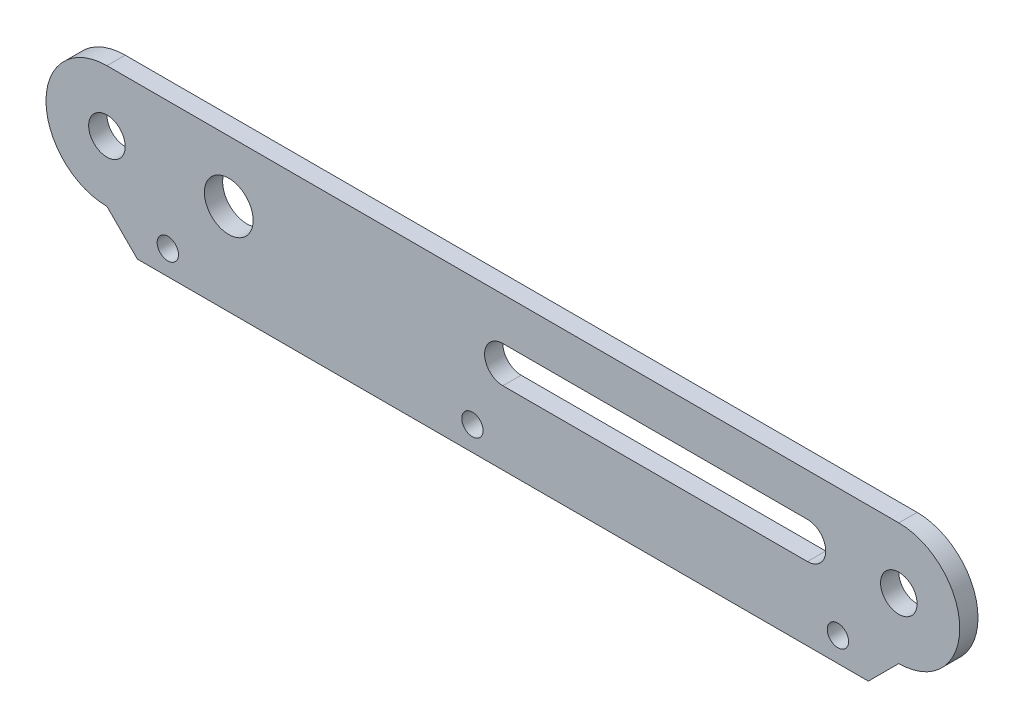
SolidWorks part; units mm, degrees
ref_plane "Front Plane" through (0, 0, 0) normal (0, 0, 1) x (1, 0, 0)
ref_plane "Top Plane" through (0, 0, 0) normal (0, 1, 0) x (1, 0, 0)
ref_plane "Right Plane" through (0, 0, 0) normal (1, 0, 0) x (0, 0, -1)
sketch "Sketch1" plane through (0, 0, 0) normal (0, 0, 1) x (1, 0, 0)
  line L0 (0, 0) -> (130, 0) construction
  line L1 (65, 0) -> (115, 0) construction
  line L2 (65, 3) -> (115, 3)
  line L3 (65, -3) -> (115, -3)
  line L4 (0, 10) -> (130, 10)
  line L5 (0, -10) -> (5, -15)
  line L6 (5, -15) -> (125, -15)
  line L7 (125, -15) -> (130, -10)
  line L8 (1, -11) -> (129, -11) construction
  circle A0 centre (0, 0) radius 3
  circle A1 centre (20, 0) radius 4
  circle A2 centre (130, 0) radius 3
  arc A3 (65, 3) -> (65, -3) centre (65, 0) ccw
  arc A4 (115, -3) -> (115, 3) centre (115, 0) ccw
  arc A5 (0, 10) -> (0, -10) centre (0, 0) ccw
  arc A6 (130, -10) -> (130, 10) centre (130, 0) ccw
  circle A7 centre (10, -11) radius 1.75
  circle A8 centre (60, -11) radius 1.75
  circle A9 centre (120, -11) radius 1.75
  point P9 (90, 0)
  dimension "D1" = 6
  dimension "D2" = 8
  dimension "D3" = 6
  dimension "D4" = 3
  dimension "D9" = 10
  dimension "D14" = 3.5
  dimension "D15" = 10
  dimension "D16" = 50
  dimension "D17" = 60
  dimension "D5" = 15
  dimension "D6" = 50
  dimension "D7" = 45
  dimension "D8" = 20
  dimension "D10" = 5
  dimension "D11" = 11
  dimension "D12" = 45
  dimension "D13" = 45
extrude "Boss-Extrude1" add sketch "Sketch1" along normal blind 3
